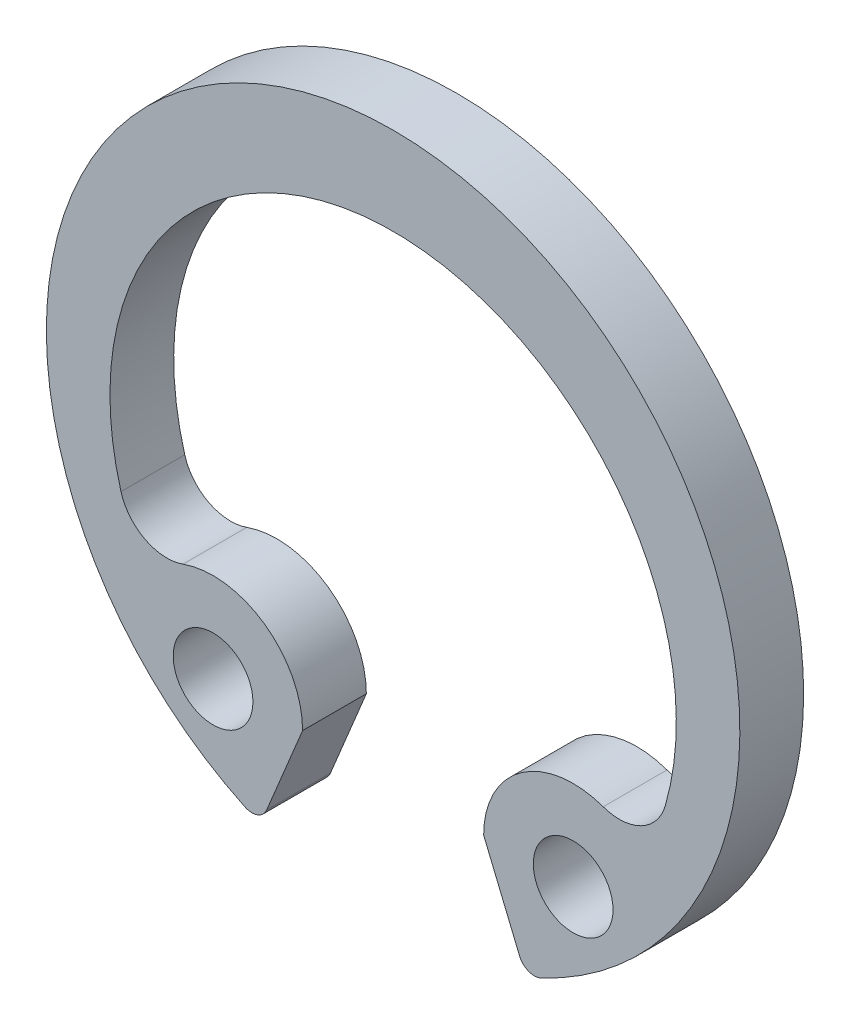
SolidWorks part; units mm, degrees
ref_plane "Front Plane" through (0, 0, 0) normal (0, 0, 1) x (1, 0, 0)
ref_plane "Top Plane" through (0, 0, 0) normal (0, 1, 0) x (1, 0, 0)
ref_plane "Right Plane" through (0, 0, 0) normal (1, 0, 0) x (0, 0, -1)
sketch "BodySke" plane through (0, 0, 0) normal (0, 0, 1) x (1, 0, 0)
  line L0 (0, -7.6074) -> (0, 7.215) construction
  line L1 (1.1357, -2.7419) -> (1.6647, -4.0189)
  line L2 (-1.1357, -2.7419) -> (-1.6647, -4.0189)
  line L3 (1.6647, -4.0189) -> (5.9992, -4.0189) construction
  line L4 (2.6886, -1.7044) -> (3.1709, -1.9042)
  line L5 (-2.6886, -1.7044) -> (-3.1709, -1.9042)
  arc A0 (1.6647, -4.0189) -> (-1.6647, -4.0189) centre (0, 0) ccw
  arc A1 (0, -3.855) -> (3.1134, -2.0133) centre (0, -0.3025) ccw construction
  circle A2 centre (2.2588, -2.7419) radius 0.5
  circle A3 centre (0, 0) radius 3.5525 construction
  circle A4 centre (-2.2588, -2.7419) radius 0.5
  arc A5 (-3.1709, -1.9042) -> (3.1709, -1.9042) centre (0, -0.3025) cw
  arc A6 (3.1134, -2.0133) -> (3.0018, -1.8998) centre (2.2588, -2.7419) ccw construction
  arc A8 (2.6886, -1.7044) -> (1.1357, -2.7419) centre (2.2588, -2.7419) ccw
  arc A9 (3.1709, -1.9042) -> (-3.1709, -1.9042) centre (0, -0.3025) ccw
  arc A10 (-2.6886, -1.7044) -> (-1.1357, -2.7419) centre (-2.2588, -2.7419) cw
  dimension "D1" = 45
  dimension "Groove_Diameter" = 8.7
  dimension "D2" = 22.5
  dimension "D3" = 7.105
  dimension "Hole_dia" = 1
  dimension "Groove_depth" = 1.1
  dimension "Groove_length" = 2.4
extrude "BaseBody" add sketch "BodySke" along normal blind 0.8
fillet "Fillet1" radius 0.6 2 edges at (3.1709, -1.9042, 0.4) (-3.1709, -1.9042, 0.4)
fillet "Fillet2" radius 0.2 2 edges at (1.6647, -4.0189, 0.4) (-1.6647, -4.0189, 0.4)
equation "\"D3@BodySke\" = \"Groove_Diameter@BodySke\" - 1.45 * \"Groove_depth@BodySke\""
equation "\"D1@Fillet1\" = \"Hole_dia@BodySke\" * 0.6"
equation "\"D1@Fillet2\" = \"Hole_dia@BodySke\" * 0.2"
